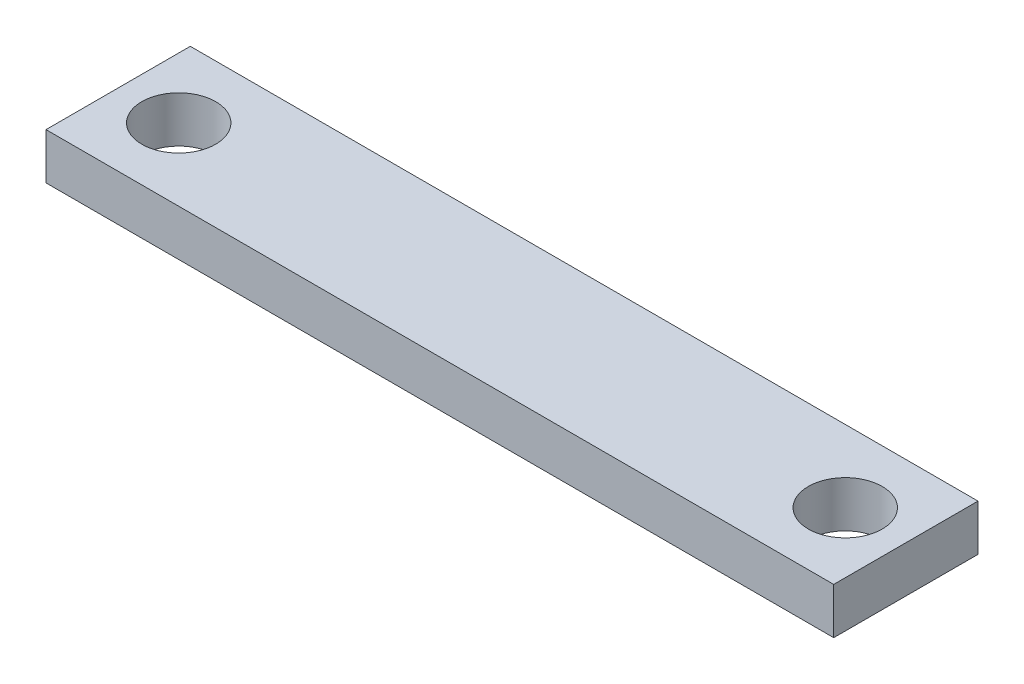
SolidWorks part; units mm, degrees
ref_plane "Front Plane" through (0, 0, 0) normal (0, 0, 1) x (1, 0, 0)
ref_plane "Top Plane" through (0, 0, 0) normal (0, 1, 0) x (1, 0, 0)
ref_plane "Right Plane" through (0, 0, 0) normal (1, 0, 0) x (0, 0, -1)
sketch "Sketch1" plane through (0, 0, 0) normal (0, 1, 0) x (1, 0, 0)
  line L0 (0, 2.3813) -> (0, -2.3812) construction
  line L1 (13, -2.3812) -> (-13, -2.3812)
  line L2 (13, -2.3812) -> (13, 2.3813)
  line L3 (13, 2.3813) -> (-13, 2.3813)
  line L4 (-13, -2.3812) -> (-13, 2.3813)
  line L5 (13, -2.3812) -> (-13, 2.3813) construction
  line L6 (13, 2.3813) -> (-13, -2.3812) construction
  point P0 (0, 0)
  dimension "D1" = 4.7625
  dimension "D2" = 26
extrude "Boss-Extrude1" add sketch "Sketch1" along normal blind 1.524
sketch "Sketch3" plane through (0, 0, 0) normal (0, 0, 1) x (1, 0, 0)
  line L0 (-13, 0) -> (13, 0) construction
  line L1 (0, 0) -> (0, 1.524) construction
  line L2 (-13, 1.524) -> (13, 1.524) construction
  line L3 (3.313, 0) -> (-3.313, 0)
  arc A0 (-3.313, 0) -> (3.313, 0) centre (0, 4.5) ccw
  dimension "D1" = 5.588
  dimension "D2" = 4.5
extrude "Boss-Extrude2" [suppressed] add sketch "Sketch3" along normal mid plane 4
sketch "Sketch4" plane through (0, 1.524, 0) normal (0, 1, 0) x (1, 0, 0)
  line L0 (-11, 0) -> (11, 0)
  line L1 (-13, -2.3812) -> (13, -2.3812) construction
  line L2 (-13, 2.3813) -> (-13, -2.3812) construction
  dimension "D1" = 22
  dimension "D2" = 2
  dimension "D3" = 2.3813
hole_wizard "#2 Clearance Hole1" positions "Sketch6" profile "Sketch5" hole size "#2" standard "ANSI Inch"
sketch "Sketch6" plane through (0, 1.524, 0) normal (0, 1, 0) x (1, 0, 0)
  point P0 (-11, 0)
  point P3 (11, 0)
sketch "Sketch5" plane through (-11, 1.524, 0) normal (1, 0, 0) x (0, 0, 1)
  line L0 (0, 0) -> (0, 1.524)
  line L1 (0, 1.524) -> (1.2192, 1.524)
  line L2 (1.2192, 1.524) -> (1.2192, 0)
  line L5 (1.2192, 0) -> (0, 0)
  line L11 (0, -6.35) -> (0, 107.95) construction
  dimension "Thru Hole Dia." = 2.4384
  dimension "Thru Hole Depth" = 1.524
